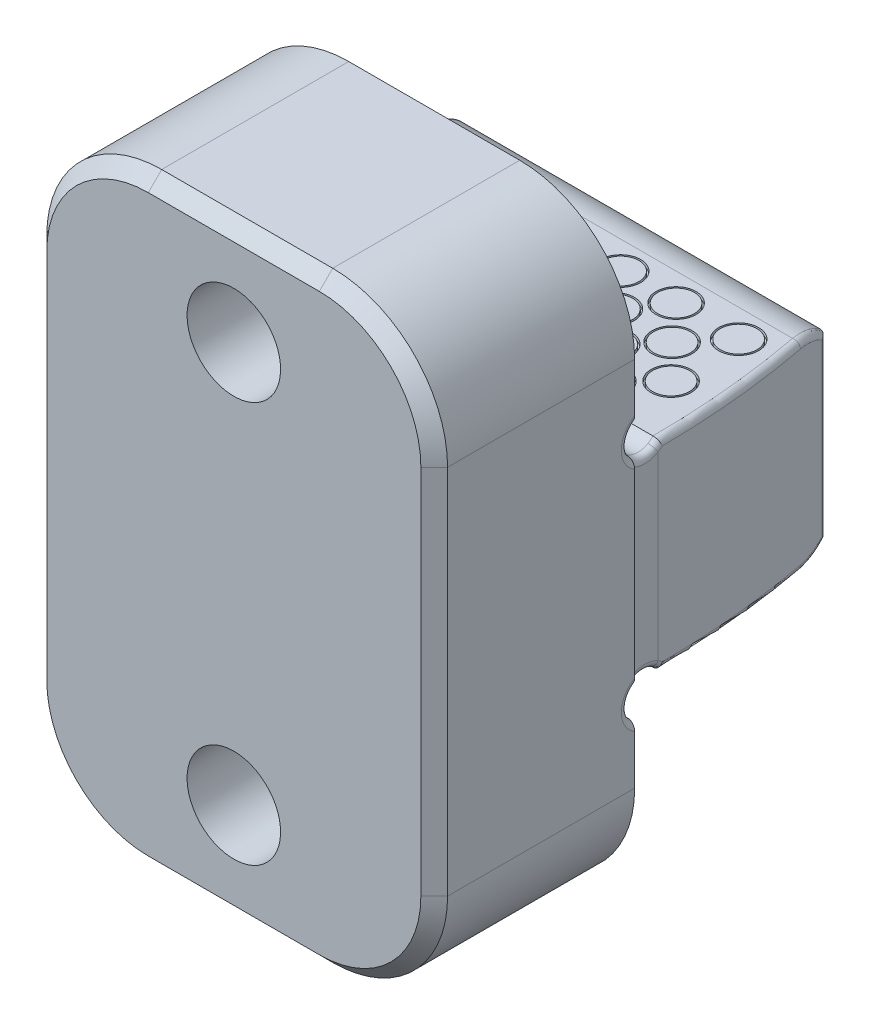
SolidWorks part; units mm, degrees
ref_plane "Front Plane" through (0, 0, 0) normal (0, 0, 1) x (1, 0, 0)
ref_plane "Top Plane" through (0, 0, 0) normal (0, 1, 0) x (1, 0, 0)
ref_plane "Right Plane" through (0, 0, 0) normal (1, 0, 0) x (0, 0, -1)
sketch "Sketch3" plane through (0, 0, 0) normal (1, 0, 0) x (0, 0, -1)
  line L0 (0, 16.5) -> (0, -16.5) construction
  line L1 (-15, -22.5) -> (0, -22.5)
  line L2 (-15, -22.5) -> (-15, 22.5)
  line L3 (-15, 22.5) -> (0, 22.5)
  line L4 (16.17, -7.4975) -> (16.17, 7.4975)
  line L6 (0, -22.5) -> (0, -7.4975)
  line L7 (0, -7.4975) -> (16.17, -7.4975)
  line L8 (0, 22.5) -> (0, 7.4975)
  line L9 (0, 7.4975) -> (16.17, 7.4975)
  line L10 (0, 0) -> (50000, 0) construction
  dimension "D1" = 31.17
  dimension "D2" = 15
  dimension "D3" = 45
  dimension "D4" = 14.995
extrude "Extrude1" add sketch "Sketch3" along normal mid plane 30
sketch "Sketch7" plane through (15, 0, 0) normal (1, 0, 0) x (0, 0, -1)
  line L0 (0, 22.5) -> (-15, 22.5) construction
  line L1 (0, -22.5) -> (21.9683, -22.5)
  line L2 (0, -22.5) -> (0, 22.5)
  line L3 (0, 22.5) -> (21.9683, 22.5)
  line L4 (21.9683, -22.5) -> (21.9683, 22.5)
  line L5 (0, -22.5) -> (0, -7.4975) construction
  line L6 (-15, -22.5) -> (0, -22.5) construction
extrude "Cut-Extrude3" cut sketch "Sketch7" against normal blind 0.25
sketch "Sketch8" plane through (15, 0, 0) normal (1, 0, 0) x (0, 0, -1)
  line L0 (0, 0) -> (50000, 0) construction
  line L1 (0, -22.5) -> (0, 22.5) construction
  line L2 (0, 7.4975) -> (16.17, 7.4975) construction
  circle A0 centre (1, 8.4975) radius 1.5
  circle A1 centre (1, -8.4975) radius 1.5
  dimension "D1" = 1.5
  dimension "D2" = 0.5
  dimension "D3" = 0.5
extrude "Cut-Extrude4" cut sketch "Sketch8" against normal through all
sketch "Sketch9" plane through (15, 0, 0) normal (1, 0, 0) x (0, 0, -1)
  line L0 (2.118, 7.4975) -> (16.17, 7.4975) construction
  line L1 (16.17, 7.4975) -> (16.17, -7.4975) construction
  line L2 (0, 0) -> (50000, 0) construction
  line L3 (16.17, 6.6385) -> (20.17, 6.6385)
  line L4 (13.67, 7.4975) -> (13.67, 13.1385)
  line L5 (13.67, 13.1385) -> (20.17, 13.1385)
  line L6 (20.17, 6.6385) -> (20.17, 13.1385)
  line L7 (20.17, -6.6385) -> (20.17, -13.1385)
  line L8 (13.67, -13.1385) -> (20.17, -13.1385)
  line L9 (13.67, -7.4975) -> (13.67, -13.1385)
  line L10 (16.17, -6.6385) -> (20.17, -6.6385)
  arc A0 (13.67, 7.4975) -> (15.8439, 7.1072) centre (13.67, 1.2475) cw construction
  arc A1 (15.8439, 7.1072) -> (16.17, 6.6385) centre (15.67, 6.6385) cw construction
  arc A2 (15.8439, -7.1072) -> (16.17, -6.6385) centre (15.67, -6.6385) ccw construction
  arc A3 (13.67, -7.4975) -> (15.8439, -7.1072) centre (13.67, -1.2475) ccw construction
  arc A4 (13.67, 7.4975) -> (16.17, 6.6385) centre (13.67, 3.4302) cw
  arc A5 (13.67, -7.4975) -> (16.17, -6.6385) centre (13.67, -3.4302) ccw
  dimension "D1" = 0.5
  dimension "D2" = 6.25
  dimension "D3" = 2.5
  dimension "D4" = 6.5
  dimension "D5" = 6.5
extrude "Cut-Extrude5" cut sketch "Sketch9" against normal through all
sketch "Sketch13" plane through (0, 22.5, 0) normal (0, 1, 0) x (1, 0, 0)
  line L0 (14.75, 2.118) -> (14.75, 13.67) construction
  line L2 (9.5773, 27) -> (29.5773, 27)
  line L4 (14.75, 2) -> (29.5773, 2)
  line L5 (29.5773, 27) -> (29.5773, 2)
  arc A0 (9.5773, 27) -> (14.75, 2) centre (-48.25, 2) cw
  dimension "D1" = 63
  dimension "D2" = 2
  dimension "D3" = 25
  dimension "D4" = 20
extrude "Cut-Extrude6" cut sketch "Sketch13" against normal through all
sketch "Sketch15" plane through (0, 7.4975, 0) normal (0, 1, 0) x (1, 0, 0)
  circle A0 centre (11.1858, 11.5961) radius 1.5
  circle A1 centre (11.1858, 11.5961) radius 1.37
  circle A2 centre (-6.8755, 11.5961) radius 1.5
  circle A3 centre (-6.8755, 11.5961) radius 1.37
  circle A4 centre (-12.0041, 11.5961) radius 1.5
  circle A5 centre (-12.0041, 11.5961) radius 1.37
  circle A6 centre (6.5032, 11.5961) radius 1.5
  circle A7 centre (6.5032, 11.5961) radius 1.37
  circle A8 centre (2.3558, 11.5961) radius 1.5
  circle A9 centre (2.3558, 11.5961) radius 1.37
  circle A10 centre (-2.193, 11.5961) radius 1.5
  circle A11 centre (-2.193, 11.5961) radius 1.37
  circle A12 centre (11.3732, 6.3527) radius 1.5
  circle A13 centre (11.3732, 6.3527) radius 1.37
  circle A14 centre (-4.4582, 8.9083) radius 1.5
  circle A15 centre (-4.4582, 8.9083) radius 1.37
  circle A16 centre (-9.1729, 8.9083) radius 1.5
  circle A17 centre (-9.1729, 8.9083) radius 1.37
  circle A18 centre (8.8929, 8.9083) radius 1.5
  circle A19 centre (8.8929, 8.9083) radius 1.37
  circle A20 centre (4.5747, 8.9083) radius 1.5
  circle A21 centre (4.5747, 8.9083) radius 1.37
  circle A22 centre (0, 8.9083) radius 1.5
  circle A23 centre (0, 8.9083) radius 1.37
  circle A24 centre (-6.6882, 6.3527) radius 1.5
  circle A25 centre (-6.6882, 6.3527) radius 1.37
  circle A26 centre (-11.8167, 6.3527) radius 1.5
  circle A27 centre (-11.8167, 6.3527) radius 1.37
  circle A28 centre (6.7629, 6.5196) radius 1.5
  circle A29 centre (6.7629, 6.5196) radius 1.37
  circle A30 centre (2.5432, 6.3527) radius 1.5
  circle A31 centre (2.5432, 6.3527) radius 1.37
  circle A32 centre (-2.0056, 6.3527) radius 1.5
  circle A33 centre (-2.0056, 6.3527) radius 1.37
  circle A34 centre (-4.326, 3.9733) radius 1.5
  circle A35 centre (-4.326, 3.9733) radius 1.37
  circle A36 centre (-9.0407, 3.9733) radius 1.5
  circle A37 centre (-9.0407, 3.9733) radius 1.37
  circle A38 centre (9.0251, 3.9733) radius 1.5
  circle A39 centre (9.0251, 3.9733) radius 1.37
  circle A40 centre (4.7069, 3.9733) radius 1.5
  circle A41 centre (4.7069, 3.9733) radius 1.37
  circle A42 centre (0.1322, 3.9733) radius 1.5
  circle A43 centre (0.1322, 3.9733) radius 1.37
  dimension "D3" = 3
  dimension "D4" = 2.74
extrude "Cut-Extrude7" cut sketch "Sketch15" against normal blind 0.254
mirror "Mirror1" about plane through (0, 0, 0) normal (0, 1, 0) of "Cut-Extrude7"
hole_wizard "CBORE for M6 SHCS1" positions "Sketch17" profile "Sketch16" counterbore size "M6" standard "Ansi Metric"
sketch "Sketch17" plane through (0, 0, 0) normal (0, 0, -1) x (-1, 0, 0)
  line L0 (0, 0) -> (50000, 0) construction
  point P0 (0, 15)
  point P9 (0, -15)
  dimension "D1" = 30
sketch "Sketch16" plane through (0, 15, 0) normal (1, 0, 0) x (0, 1, 0)
  line L0 (0, 0) -> (0, 15)
  line L1 (0, 15) -> (3.5, 15)
  line L3 (3.5, 15) -> (3.5, 7)
  line L4 (3.5, 7) -> (5.5, 7)
  line L5 (5.5, 7) -> (5.5, 0)
  line L7 (5.5, 0) -> (0, 0)
  line L11 (0, -6.35) -> (0, 107.95) construction
  dimension "Thru Hole Dia." = 7
  dimension "Thru Hole Depth" = 15
  dimension "C'Bore Dia." = 11
  dimension "C'Bore Depth" = 7
fillet "Fillet1" radius 8.6 4 edges at (-15, 22.5, 7.5) (-15, -22.5, 7.5) (15, -22.5, 7.5) (15, 22.5, 7.5)
chamfer "Chamfer1" distance 1 angle 45 8 edges at (0, 22.5, 15) (-12.4811, 19.9811, 15) (-15, 0, 15) (0, -22.5, 15) (-12.4811, -19.9811, 15) (15, 0, 15) (12.4811, 19.9811, 15) (12.4811, -19.9811, 15)
chamfer "Chamfer2" distance 0.4 angle 45 4 edges at (-0.0783, -9.5006, 0.1153) (0, -20.5, 0) (0.0783, 9.5006, 0.1153) (0, 20.5, 0)
mirror "Mirror2" about plane through (0, 0, 0) normal (1, 0, 0) of "Cut-Extrude3"
fillet "Fillet2" radius 0.5 24 edges at (13.406, -7.293, -14.9436) (14.75, 6.9975, -1) (14.4713, 7.4975, -7.9192) (13.3856, 7.2597, -15.0403) (13.1358, 0, -16.17) (14.4713, -7.4975, -7.9192) (15, 8.4975, 0.5) (-15, 8.4975, 0.5) (-14.75, -7.2768, -14.9917) (-15, -8.4975, 0.5) (14.875, 7.3795, 0) (-14.75, 7.4975, -7.894) (-14.75, 6.9998, -1.0835) (-14.75, -6.9998, -1.0835) (-14.75, -7.4975, -7.894) (-14.75, 0, -16.17) (-14.75, 7.2768, -14.9917) (-14.875, 7.3795, 0) (-14.875, -7.3795, 0) (14.75, -6.9975, -1) (15, -8.4975, 0.5) (14.875, -7.3795, 0)
